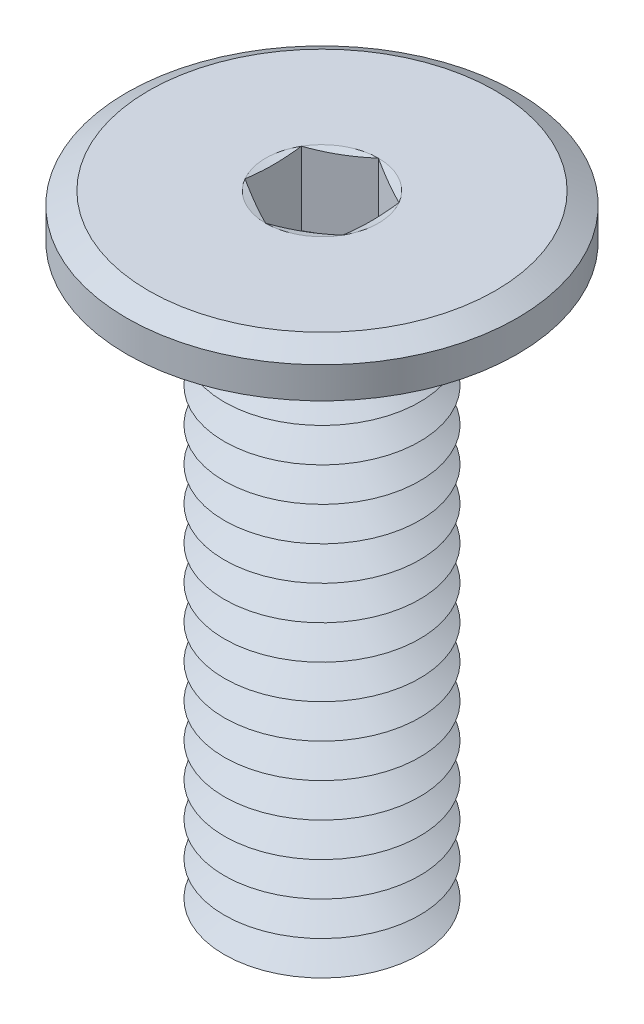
SolidWorks part; units mm, degrees
ref_plane "Front Plane" through (0, 0, 0) normal (0, 0, 1) x (1, 0, 0)
ref_plane "Top Plane" through (0, 0, 0) normal (0, 1, 0) x (1, 0, 0)
ref_plane "Right Plane" through (0, 0, 0) normal (1, 0, 0) x (0, 0, -1)
sketch "Sketch1" plane through (0, 0, 0) normal (0, 1, 0) x (1, 0, 0)
  circle A0 centre (0, 0) radius 4
  dimension "D1" = 8
extrude "Boss-Extrude1" add sketch "Sketch1" against normal blind 0.9
sketch "Sketch2" plane through (0, -0.9, 0) normal (0, -1, 0) x (1, 0, 0)
  circle A0 centre (0, 0) radius 2
  dimension "D1" = 4
extrude "Boss-Extrude2" add sketch "Sketch2" along normal blind 12
sketch "Sketch3" plane through (0, 0, 0) normal (1, 0, 0) x (0, 0, -1)
  line L0 (0, 0.9906) -> (0, -8.2999) construction
sketch "Sketch5" plane through (0, 0, 0) normal (1, 0, 0) x (0, 0, -1)
  line L0 (-2, -13.25) -> (-1.3938, -12.9)
  line L1 (-2, -0.9) -> (-2, -12.9) construction
  line L2 (-1.3938, -12.9) -> (-2, -12.55)
  line L3 (-2, -0.9) -> (-2, -12.9) construction
  line L4 (-2, -12.55) -> (-2, -13.25)
  line L6 (-2, -0.9) -> (-2, -12.9) construction
  line L7 (-2, -0.9) -> (-2, -12.9) construction
  line L14 (-2, -12.9) -> (2, -12.9) construction
  dimension "D1" = 0.7
revolve "Cut-Revolve1" cut sketch "Sketch5" angle 360 about L0
pattern_linear "LPattern1" count 16 spacing 0.7 along (0, 1, 0) of "Cut-Revolve1"
fillet "Fillet1" radius 0.2 1 edges at (0, -0.9, -2)
chamfer "Chamfer2" distance 0.45 angle 30 1 edges at (0, 0, 4)
sketch "Sketch6" plane through (0, 0, 0) normal (0, 1, 0) x (1, 0, 0)
  line L1 (0, 1.1547) -> (-1, 0.5774)
  line L2 (-1, 0.5774) -> (-1, -0.5774)
  line L3 (-1, -0.5774) -> (0, -1.1547)
  line L4 (0, -1.1547) -> (1, -0.5774)
  line L5 (1, -0.5774) -> (1, 0.5774)
  line L6 (1, 0.5774) -> (0, 1.1547)
  circle A0 centre (0, 0) radius 1 construction
  dimension "D1" = 2
extrude "Cut-Extrude1" cut sketch "Sketch6" against normal blind 1.5
sketch "Sketch7" plane through (0, -1.5, 0) normal (0, 1, 0) x (1, 0, 0)
  line L0 (-1, 0.5774) -> (-1, -0.5774) construction
  circle A0 centre (0, 0) radius 1
extrude "Cut-Extrude2" cut sketch "Sketch7" against normal through all draft 60
sketch "Sketch8" plane through (0, 0, 0) normal (0, 1, 0) x (1, 0, 0)
  circle A0 centre (0, 0) radius 1.1547
extrude "Cut-Extrude3" cut sketch "Sketch8" against normal through all draft 75
